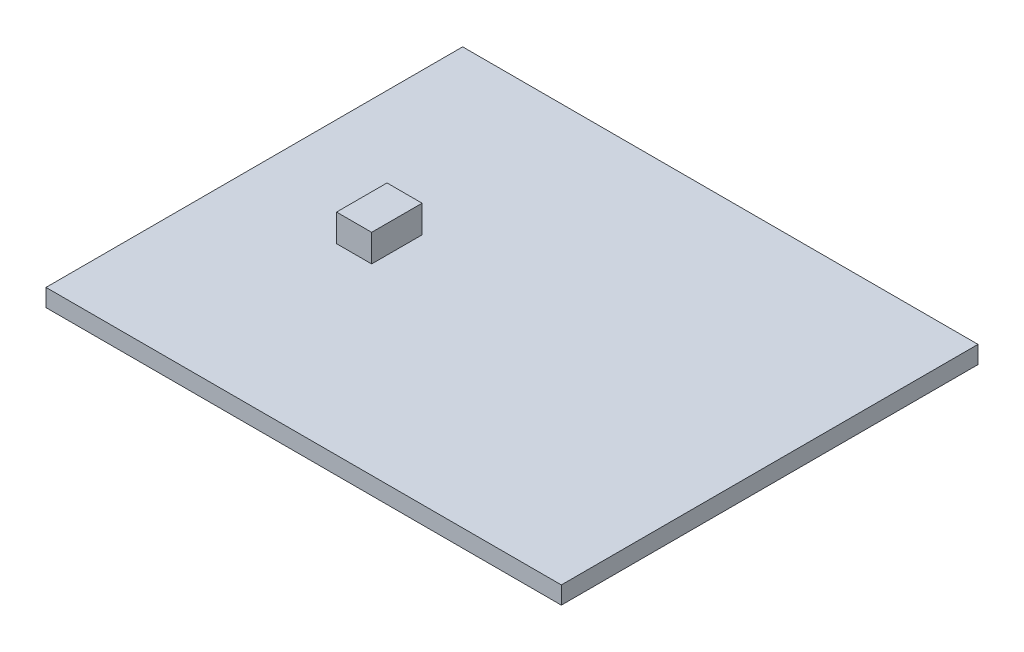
SolidWorks part; units mm, degrees
ref_plane "Front Plane" through (0, 0, 0) normal (0, 0, 1) x (1, 0, 0)
ref_plane "Top Plane" through (0, 0, 0) normal (0, 1, 0) x (1, 0, 0)
ref_plane "Right Plane" through (0, 0, 0) normal (1, 0, 0) x (0, 0, -1)
sketch "Sketch1" plane through (0, 0, 0) normal (0, 1, 0) x (1, 0, 0)
  line L1 (0, 0) -> (47, 0)
  line L2 (0, 0) -> (0, 38)
  line L3 (0, 38) -> (47, 38)
  line L4 (47, 0) -> (47, 38)
  dimension "D1" = 38
  dimension "D2" = 47
extrude "Boss-Extrude1" add sketch "Sketch1" along normal blind 1.6
sketch "Sketch2" plane through (0, 1.6, 0) normal (0, 1, 0) x (1, 0, 0)
  line L0 (11.4, 21.3) -> (11.4, 16.7) construction
  line L1 (9.8, 21.3) -> (13, 21.3)
  line L2 (9.8, 21.3) -> (9.8, 16.7)
  line L3 (9.8, 16.7) -> (13, 16.7)
  line L4 (13, 21.3) -> (13, 16.7)
  line L5 (9.8, 19) -> (13, 19) construction
  line L6 (47, 38) -> (0, 38) construction
  line L8 (0, 38) -> (0, 0) construction
  dimension "D1" = 19
  dimension "D2" = 4.6
  dimension "D3" = 3.2
  dimension "D4" = 11.4
extrude "Boss-Extrude2" add sketch "Sketch2" along normal blind 2.5
sketch "Sketch3" plane through (0, 0, 0) normal (0, -1, 0) x (1, 0, 0)
  line L0 (9.8, -16.7) -> (13, -16.7) construction
  line L1 (9.8, -21.3) -> (9.8, -16.7) construction
  line L2 (13, -21.3) -> (9.8, -21.3) construction
  line L3 (13, -16.7) -> (13, -21.3) construction
  line L4 (9.8, -16.7) -> (13, -16.7)
  line L5 (9.8, -21.3) -> (9.8, -16.7)
  line L6 (13, -21.3) -> (9.8, -21.3)
  line L7 (13, -16.7) -> (13, -21.3)
extrude "Boss-Extrude3" add sketch "Sketch3" along normal blind 2.5
